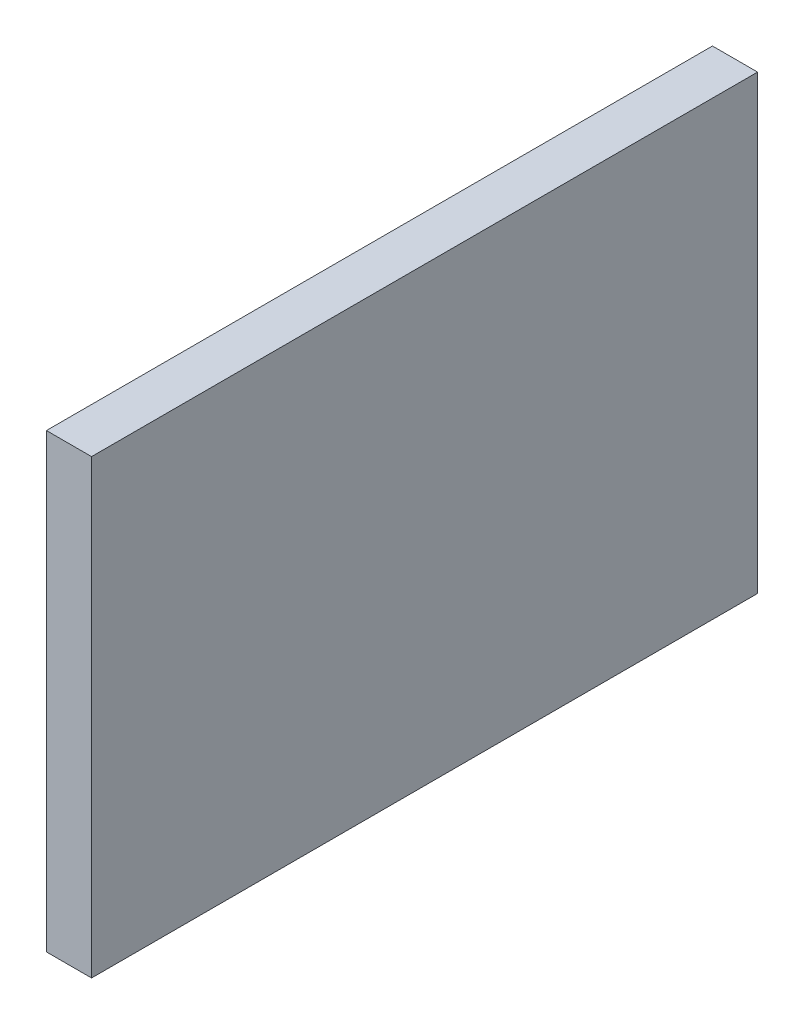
SolidWorks part; units mm, degrees
ref_plane "Front Plane" through (0, 0, 0) normal (0, 0, 1) x (1, 0, 0)
ref_plane "Top Plane" through (0, 0, 0) normal (0, 1, 0) x (1, 0, 0)
ref_plane "Right Plane" through (0, 0, 0) normal (1, 0, 0) x (0, 0, -1)
sketch "Sketch2" plane through (0, 0, 0) normal (1, 0, 0) x (0, 0, -1)
  line L1 (-15.0864, 12.9108) -> (14.4136, 12.9108)
  line L2 (-15.0864, 12.9108) -> (-15.0864, -7.0892)
  line L3 (-15.0864, -7.0892) -> (14.4136, -7.0892)
  line L4 (14.4136, 12.9108) -> (14.4136, -7.0892)
  dimension "D1" = 20
  dimension "D2" = 29.5
extrude "Boss-Extrude1" add sketch "Sketch2" along normal blind 2
